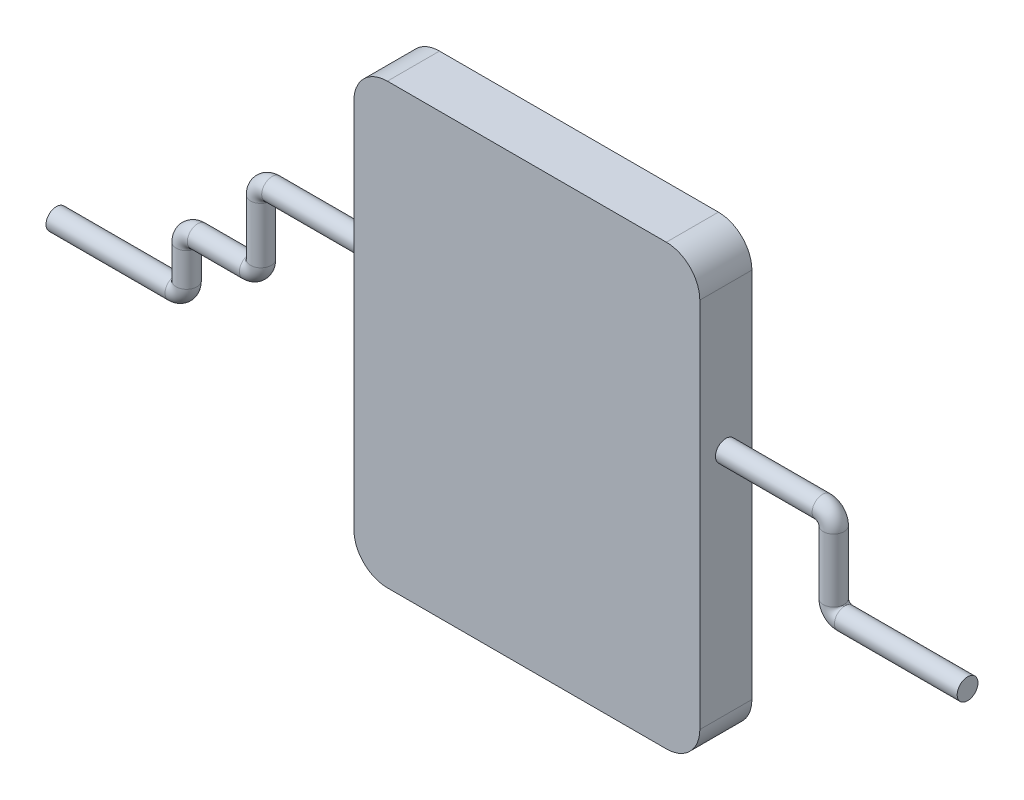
SolidWorks part; units mm, degrees
ref_plane "Front Plane" through (0, 0, 0) normal (0, 0, 1) x (1, 0, 0)
ref_plane "Top Plane" through (0, 0, 0) normal (0, 1, 0) x (1, 0, 0)
ref_plane "Right Plane" through (0, 0, 0) normal (1, 0, 0) x (0, 0, -1)
sketch "Sketch1" plane through (0, 0, 0) normal (0, 0, 1) x (1, 0, 0)
  line L1 (-11.811, -14.986) -> (11.811, -14.986)
  line L2 (-11.811, -14.986) -> (-11.811, 14.986)
  line L3 (-11.811, 14.986) -> (11.811, 14.986)
  line L4 (11.811, -14.986) -> (11.811, 14.986)
  line L5 (-11.811, -14.986) -> (11.811, 14.986) construction
  line L6 (-11.811, 14.986) -> (11.811, -14.986) construction
  point P0 (0, 0)
  dimension "D1" = 23.622
  dimension "D2" = 29.972
extrude "Boss-Extrude1" add sketch "Sketch1" along normal mid plane 3.556
fillet "Fillet1" radius 2.286 4 edges at (11.811, -14.986, 0) (-11.811, -14.986, 0) (-11.811, 14.986, 0) (11.811, 14.986, 0)
sketch "Sketch2" plane through (0, 0, 0) normal (0, 0, 1) x (1, 0, 0)
  line L0 (11.811, 2.921) -> (18.415, 2.921)
  line L1 (11.811, -12.7) -> (11.811, 12.7) construction
  line L2 (19.177, 2.159) -> (19.177, -2.159)
  line L3 (19.939, -2.921) -> (28.321, -2.921)
  line L4 (9.525, 14.986) -> (-9.525, 14.986) construction
  arc A0 (19.177, -2.159) -> (19.939, -2.921) centre (19.939, -2.159) ccw
  arc A1 (18.415, 2.921) -> (19.177, 2.159) centre (18.415, 2.159) cw
  point P10 (19.177, -2.921)
  point P13 (19.177, 2.921)
  dimension "D5" = 0.762
  dimension "D1" = 7.366
  dimension "D2" = 12.065
  dimension "D3" = 5.842
  dimension "D4" = 9.144
sketch "Sketch3" plane through (11.811, 0, 0) normal (1, 0, 0) x (0, 0, -1)
  circle A0 centre (0, 2.921) radius 0.7112
  dimension "D1" = 1.4224
sweep "Sweep1" add profiles "Sketch3" path "Sketch2"
sketch "Sketch4" plane through (0, 0, 0) normal (0, 0, 1) x (1, 0, 0)
  line L0 (-11.811, 2.921) -> (-19.177, 2.921)
  line L1 (-11.811, 12.7) -> (-11.811, -12.7) construction
  line L2 (11.811, 2.921) -> (-5.7932, 2.921) construction
  line L3 (11.811, -12.7) -> (11.811, 12.7) construction
  line L4 (11.811, 2.2098) -> (11.811, 3.6322) construction
  line L5 (-19.939, 2.159) -> (-19.939, -1.651)
  line L6 (-20.701, -2.413) -> (-24.257, -2.413)
  line L7 (-25.019, -3.175) -> (-25.019, -5.461)
  line L8 (-25.781, -6.223) -> (-33.909, -6.223)
  arc A0 (-19.177, 2.921) -> (-19.939, 2.159) centre (-19.177, 2.159) ccw
  arc A1 (-19.939, -1.651) -> (-20.701, -2.413) centre (-20.701, -1.651) cw
  arc A2 (-24.257, -2.413) -> (-25.019, -3.175) centre (-24.257, -3.175) ccw
  arc A3 (-25.019, -5.461) -> (-25.781, -6.223) centre (-25.781, -5.461) cw
  point P16 (-19.939, 2.921)
  point P19 (-19.939, -2.413)
  point P22 (-25.019, -2.413)
  point P25 (-25.019, -6.223)
  dimension "D6" = 0.762
  dimension "D1" = 8.128
  dimension "D2" = 5.334
  dimension "D3" = 5.08
  dimension "D4" = 3.81
  dimension "D5" = 8.89
sketch "Sketch6" plane through (-11.811, 0, 0) normal (-1, 0, 0) x (0, 0, 1)
  circle A0 centre (0, 2.921) radius 0.7112
  dimension "D1" = 1.4224
sweep "Sweep2" add profiles "Sketch6" path "Sketch4"
